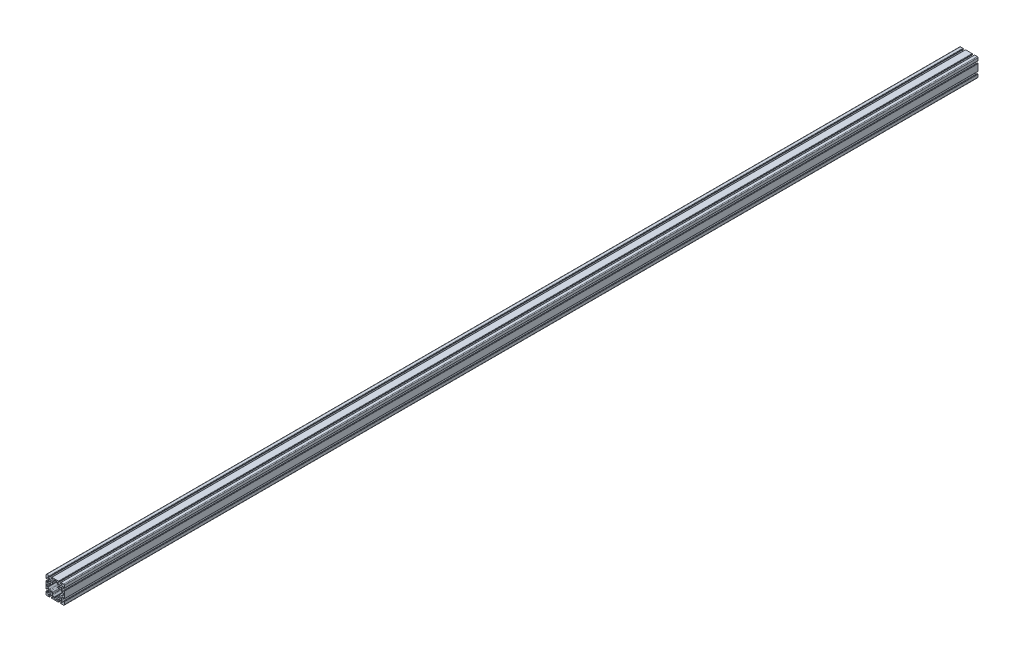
SolidWorks part; units mm, degrees
ref_plane "Front Plane" through (0, 0, 0) normal (0, 0, 1) x (1, 0, 0)
ref_plane "Top Plane" through (0, 0, 0) normal (0, 1, 0) x (1, 0, 0)
ref_plane "Right Plane" through (0, 0, 0) normal (1, 0, 0) x (0, 0, -1)
sketch "Sketch1" plane through (0, 0, 0) normal (0, 0, 1) x (1, 0, 0)
  line L0 (0, -40) -> (0, 40) construction
  line L1 (0, 0) -> (-43.5804, 43.5804) construction
  line L2 (-20, 20) -> (-47.7323, 20) construction
  line L3 (-20, 20) -> (3.796, 43.796) construction
  line L4 (-20, 20) -> (-20, 43.5758) construction
  line L5 (-20, -27.7) -> (-20, -47.5576) construction
  line L131 (29.0912, 26.0365) -> (33.0827, 30.028)
  line L132 (27.7, 17.3222) -> (27.7, 22.6778)
  line L133 (29.0912, 13.9635) -> (33.0827, 9.972)
  line L134 (33.6201, 9.7494) -> (34.11, 9.7494)
  line L135 (35.68, 11.3194) -> (35.68, 14.2221)
  line L136 (37.25, 15.7921) -> (38.43, 15.7921)
  line L137 (40, 14.2221) -> (40, 7.0214)
  line L138 (40, 7.0214) -> (40, -7.0214)
  line L139 (40, -7.0214) -> (40, -14.2221)
  line L140 (38.43, -15.7921) -> (37.25, -15.7921)
  line L141 (35.68, -14.2221) -> (35.68, -11.3194)
  line L142 (33.6201, -9.7494) -> (34.11, -9.7494)
  line L143 (29.0912, -13.9635) -> (33.0827, -9.972)
  line L144 (27.7, -22.6778) -> (27.7, -17.3222)
  line L145 (29.0912, -26.0365) -> (33.0827, -30.028)
  line L146 (33.6201, -30.2506) -> (34.11, -30.2506)
  line L147 (35.68, -28.6806) -> (35.68, -25.7779)
  line L148 (37.25, -24.2079) -> (38.43, -24.2079)
  line L149 (40, -25.7779) -> (40, -33.0259)
  line L150 (40, -33.0259) -> (40, -36.83)
  line L151 (36.83, -40) -> (32.9998, -40)
  line L152 (32.9998, -40) -> (25.5696, -40)
  line L153 (23.9996, -38.43) -> (23.9996, -37.25)
  line L154 (25.5696, -35.68) -> (28.4723, -35.68)
  line L155 (30.0413, -34.0552) -> (30.0171, -33.3605)
  line L156 (29.7949, -32.8496) -> (26.0365, -29.0912)
  line L157 (17.3222, -27.7) -> (22.6778, -27.7)
  line L158 (10.035, -33.0197) -> (13.9635, -29.0912)
  line L159 (9.8124, -33.8926) -> (9.8124, -33.5571)
  line L160 (11.3824, -35.4626) -> (14.4246, -35.4626)
  line L161 (15.9946, -37.0326) -> (15.9946, -38.43)
  line L162 (14.4246, -40) -> (6.9987, -40)
  line L163 (6.9987, -40) -> (-6.9987, -40)
  line L164 (-6.9987, -40) -> (-14.4292, -40)
  line L165 (-15.9992, -38.43) -> (-15.9992, -37.25)
  line L166 (-14.4292, -35.68) -> (-11.5265, -35.68)
  line L167 (-9.9574, -34.0552) -> (-9.9816, -33.3618)
  line L168 (-10.2038, -32.8509) -> (-13.9635, -29.0912)
  line L169 (-22.6778, -27.7) -> (-17.3222, -27.7)
  line L170 (-30.028, -33.0827) -> (-26.0365, -29.0912)
  line L171 (-30.2506, -34.11) -> (-30.2506, -33.6201)
  line L172 (-28.6806, -35.68) -> (-25.7231, -35.68)
  line L173 (-24.1531, -37.25) -> (-24.1531, -38.43)
  line L174 (-25.7231, -40) -> (-33, -40)
  line L175 (-33, -40) -> (-36.83, -40)
  line L176 (-40, -36.83) -> (-40, -33.0191)
  line L177 (-40, -33.0191) -> (-40, -25.591)
  line L178 (-38.43, -24.021) -> (-37.25, -24.021)
  line L179 (-35.68, -28.4937) -> (-35.68, -25.591)
  line L180 (-34.0552, -30.0627) -> (-33.3827, -30.0392)
  line L181 (-32.8718, -29.8171) -> (-29.0912, -26.0365)
  line L182 (-27.7, -22.6778) -> (-27.7, -17.3222)
  line L183 (-29.0912, -13.9635) -> (-33.0827, -9.972)
  line L184 (-34.11, -9.7494) -> (-33.6201, -9.7494)
  line L185 (-35.68, -11.3194) -> (-35.68, -14.4473)
  line L186 (-38.43, -16.0173) -> (-37.25, -16.0173)
  line L187 (-40, -14.4473) -> (-40, -7.0169)
  line L188 (-40, -7.0169) -> (-40, 7.0169)
  line L189 (-40, 7.0169) -> (-40, 14.1348)
  line L190 (-38.1948, 15.94) -> (-36.9772, 15.94)
  line L191 (-35.68, 11.3194) -> (-35.68, 14.6428)
  line L192 (-34.11, 9.7494) -> (-33.6201, 9.7494)
  line L193 (-33.0827, 9.972) -> (-29.0912, 13.9635)
  line L194 (-27.7, 17.3222) -> (-27.7, 22.6778)
  line L195 (-29.0912, 26.0365) -> (-33.0827, 30.028)
  line L196 (-34.11, 30.2506) -> (-33.6201, 30.2506)
  line L197 (-35.68, 28.6806) -> (-35.68, 25.3572)
  line L198 (-38.1948, 24.06) -> (-36.9772, 24.06)
  line L199 (-40, 25.8652) -> (-40, 33.3181)
  line L200 (-40, 33.3181) -> (-40, 36.83)
  line L201 (-36.83, 40) -> (-33.0314, 40)
  line L202 (-33.0314, 40) -> (-25.8652, 40)
  line L203 (-24.06, 36.9772) -> (-24.06, 38.1948)
  line L204 (-25.3572, 35.68) -> (-28.7018, 35.68)
  line L205 (-30.285, 33.6069) -> (-30.285, 34.0968)
  line L206 (-30.0961, 33.1508) -> (-26.0365, 29.0912)
  line L207 (-22.6778, 27.7) -> (-17.3222, 27.7)
  line L208 (-13.9635, 29.0912) -> (-9.9039, 33.1508)
  line L209 (-9.715, 33.6069) -> (-9.715, 34.0968)
  line L210 (-14.6428, 35.68) -> (-11.2982, 35.68)
  line L211 (-15.94, 36.9772) -> (-15.94, 38.1948)
  line L212 (-14.1348, 40) -> (-6.9844, 40)
  line L213 (-6.9844, 40) -> (6.9844, 40)
  line L214 (6.9844, 40) -> (14.1348, 40)
  line L215 (15.94, 36.9772) -> (15.94, 38.1948)
  line L216 (14.6428, 35.68) -> (11.2982, 35.68)
  line L217 (9.715, 33.6069) -> (9.715, 34.0968)
  line L218 (9.9039, 33.1508) -> (13.9635, 29.0912)
  line L219 (17.3222, 27.7) -> (22.6778, 27.7)
  line L220 (26.0365, 29.0912) -> (30.028, 33.0827)
  line L221 (30.2506, 33.6201) -> (30.2506, 34.11)
  line L222 (25.5409, 35.679) -> (28.6258, 35.679)
  line L223 (23.9709, 37.249) -> (23.9709, 38.43)
  line L224 (25.5409, 40) -> (36.83, 40)
  line L226 (40, 36.83) -> (40, 32.9339)
  line L227 (40, 32.9339) -> (40, 25.7779)
  line L228 (38.43, 24.2079) -> (37.0956, 24.2079)
  line L229 (35.5256, 25.7779) -> (35.5256, 28.6806)
  line L230 (33.6201, 30.2506) -> (33.9556, 30.2506)
  line L231 (17.07, 12.32) -> (22.6578, 12.32)
  line L232 (26.0165, 10.9288) -> (31.1439, 5.8014)
  line L233 (32.0419, 5.4294) -> (34.41, 5.4294)
  line L234 (35.68, -4.1594) -> (35.68, 4.1594)
  line L235 (32.0419, -5.4294) -> (34.41, -5.4294)
  line L236 (26.0165, -10.9288) -> (31.1439, -5.8014)
  line L237 (17.07, -12.32) -> (22.6578, -12.32)
  line L238 (12.32, -22.6578) -> (12.32, -17.07)
  line L239 (5.8014, -31.1439) -> (10.9288, -26.0165)
  line L240 (5.4294, -34.41) -> (5.4294, -32.0419)
  line L241 (-4.1594, -35.68) -> (4.1594, -35.68)
  line L242 (-5.4294, -34.41) -> (-5.4294, -32.0419)
  line L243 (-5.8014, -31.1439) -> (-10.9288, -26.0165)
  line L244 (-12.32, -22.6578) -> (-12.32, -17.07)
  line L245 (-22.6578, -12.32) -> (-17.07, -12.32)
  line L246 (-26.0165, -10.9288) -> (-31.1439, -5.8014)
  line L247 (-34.41, -5.4294) -> (-32.0419, -5.4294)
  line L248 (-35.68, -4.1594) -> (-35.68, 4.1594)
  line L249 (-34.41, 5.4294) -> (-32.0419, 5.4294)
  line L250 (-31.1439, 5.8014) -> (-26.0165, 10.9288)
  line L251 (-22.6578, 12.32) -> (-17.07, 12.32)
  line L252 (-12.32, 17.07) -> (-12.32, 22.6578)
  line L253 (-10.9288, 26.0165) -> (-5.8014, 31.1439)
  line L254 (-5.4294, 32.0419) -> (-5.4294, 34.41)
  line L255 (-4.1594, 35.68) -> (4.1594, 35.68)
  line L256 (5.4294, 32.0419) -> (5.4294, 34.41)
  line L257 (5.8014, 31.1439) -> (10.9288, 26.0165)
  line L258 (12.32, 17.07) -> (12.32, 22.6578)
  line L260 (-40, 0) -> (40, 0) construction
  circle A116 centre (-20, 20) radius 3.4
  circle A117 centre (20, 20) radius 3.4
  circle A118 centre (20, -20) radius 3.4
  circle A119 centre (-20, -20) radius 3.4
  arc A120 (29.0912, 26.0365) -> (27.7, 22.6778) centre (32.45, 22.6778) ccw
  arc A121 (27.7, 17.3222) -> (29.0912, 13.9635) centre (32.45, 17.3222) ccw
  arc A122 (33.0827, 9.972) -> (33.6201, 9.7494) centre (33.6201, 10.5094) ccw
  arc A123 (34.11, 9.7494) -> (35.68, 11.3194) centre (34.11, 11.3194) ccw
  arc A124 (37.25, 15.7921) -> (35.68, 14.2221) centre (37.25, 14.2221) ccw
  arc A125 (40, 14.2221) -> (38.43, 15.7921) centre (38.43, 14.2221) ccw
  arc A126 (38.43, -15.7921) -> (40, -14.2221) centre (38.43, -14.2221) ccw
  arc A127 (35.68, -14.2221) -> (37.25, -15.7921) centre (37.25, -14.2221) ccw
  arc A128 (35.68, -11.3194) -> (34.11, -9.7494) centre (34.11, -11.3194) ccw
  arc A129 (33.6201, -9.7494) -> (33.0827, -9.972) centre (33.6201, -10.5094) ccw
  arc A130 (29.0912, -13.9635) -> (27.7, -17.3222) centre (32.45, -17.3222) ccw
  arc A131 (27.7, -22.6778) -> (29.0912, -26.0365) centre (32.45, -22.6778) ccw
  arc A132 (33.0827, -30.028) -> (33.6201, -30.2506) centre (33.6201, -29.4906) ccw
  arc A133 (34.11, -30.2506) -> (35.68, -28.6806) centre (34.11, -28.6806) ccw
  arc A134 (37.25, -24.2079) -> (35.68, -25.7779) centre (37.25, -25.7779) ccw
  arc A135 (40, -25.7779) -> (38.43, -24.2079) centre (38.43, -25.7779) ccw
  arc A136 (36.83, -40) -> (40, -36.83) centre (36.83, -36.83) ccw
  arc A137 (23.9996, -38.43) -> (25.5696, -40) centre (25.5696, -38.43) ccw
  arc A138 (25.5696, -35.68) -> (23.9996, -37.25) centre (25.5696, -37.25) ccw
  arc A139 (28.4723, -35.68) -> (30.0413, -34.0552) centre (28.4723, -34.11) ccw
  arc A140 (30.0171, -33.3605) -> (29.7949, -32.8496) centre (29.2575, -33.387) ccw
  arc A141 (26.0365, -29.0912) -> (22.6778, -27.7) centre (22.6778, -32.45) ccw
  arc A142 (17.3222, -27.7) -> (13.9635, -29.0912) centre (17.3222, -32.45) ccw
  arc A143 (10.035, -33.0197) -> (9.8124, -33.5571) centre (10.5724, -33.5571) ccw
  arc A144 (9.8124, -33.8926) -> (11.3824, -35.4626) centre (11.3824, -33.8926) ccw
  arc A145 (15.9946, -37.0326) -> (14.4246, -35.4626) centre (14.4246, -37.0326) ccw
  arc A146 (14.4246, -40) -> (15.9946, -38.43) centre (14.4246, -38.43) ccw
  arc A147 (-15.9992, -38.43) -> (-14.4292, -40) centre (-14.4292, -38.43) ccw
  arc A148 (-14.4292, -35.68) -> (-15.9992, -37.25) centre (-14.4292, -37.25) ccw
  arc A149 (-11.5265, -35.68) -> (-9.9574, -34.0552) centre (-11.5265, -34.11) ccw
  arc A150 (-9.9816, -33.3618) -> (-10.2038, -32.8509) centre (-10.7412, -33.3883) ccw
  arc A151 (-13.9635, -29.0912) -> (-17.3222, -27.7) centre (-17.3222, -32.45) ccw
  arc A152 (-22.6778, -27.7) -> (-26.0365, -29.0912) centre (-22.6778, -32.45) ccw
  arc A153 (-30.028, -33.0827) -> (-30.2506, -33.6201) centre (-29.4906, -33.6201) ccw
  arc A154 (-30.2506, -34.11) -> (-28.6806, -35.68) centre (-28.6806, -34.11) ccw
  arc A155 (-24.1531, -37.25) -> (-25.7231, -35.68) centre (-25.7231, -37.25) ccw
  arc A156 (-25.7231, -40) -> (-24.1531, -38.43) centre (-25.7231, -38.43) ccw
  arc A157 (-40, -36.83) -> (-36.83, -40) centre (-36.83, -36.83) ccw
  arc A158 (-38.43, -24.021) -> (-40, -25.591) centre (-38.43, -25.591) ccw
  arc A159 (-35.68, -25.591) -> (-37.25, -24.021) centre (-37.25, -25.591) ccw
  arc A160 (-35.68, -28.4937) -> (-34.0552, -30.0627) centre (-34.11, -28.4937) ccw
  arc A161 (-33.3827, -30.0392) -> (-32.8718, -29.8171) centre (-33.4092, -29.2797) ccw
  arc A162 (-29.0912, -26.0365) -> (-27.7, -22.6778) centre (-32.45, -22.6778) ccw
  arc A163 (-27.7, -17.3222) -> (-29.0912, -13.9635) centre (-32.45, -17.3222) ccw
  arc A164 (-33.0827, -9.972) -> (-33.6201, -9.7494) centre (-33.6201, -10.5094) ccw
  arc A165 (-34.11, -9.7494) -> (-35.68, -11.3194) centre (-34.11, -11.3194) ccw
  arc A166 (-37.25, -16.0173) -> (-35.68, -14.4473) centre (-37.25, -14.4473) ccw
  arc A167 (-40, -14.4473) -> (-38.43, -16.0173) centre (-38.43, -14.4473) ccw
  arc A168 (-38.1948, 15.94) -> (-40, 14.1348) centre (-38.1948, 14.1348) ccw
  arc A169 (-35.68, 14.6428) -> (-36.9772, 15.94) centre (-36.9772, 14.6428) ccw
  arc A170 (-35.68, 11.3194) -> (-34.11, 9.7494) centre (-34.11, 11.3194) ccw
  arc A171 (-33.6201, 9.7494) -> (-33.0827, 9.972) centre (-33.6201, 10.5094) ccw
  arc A172 (-29.0912, 13.9635) -> (-27.7, 17.3222) centre (-32.45, 17.3222) ccw
  arc A173 (-27.7, 22.6778) -> (-29.0912, 26.0365) centre (-32.45, 22.6778) ccw
  arc A174 (-33.0827, 30.028) -> (-33.6201, 30.2506) centre (-33.6201, 29.4906) ccw
  arc A175 (-34.11, 30.2506) -> (-35.68, 28.6806) centre (-34.11, 28.6806) ccw
  arc A176 (-36.9772, 24.06) -> (-35.68, 25.3572) centre (-36.9772, 25.3572) ccw
  arc A177 (-40, 25.8652) -> (-38.1948, 24.06) centre (-38.1948, 25.8652) ccw
  arc A178 (-36.83, 40) -> (-40, 36.83) centre (-36.83, 36.83) ccw
  arc A179 (-24.06, 38.1948) -> (-25.8652, 40) centre (-25.8652, 38.1948) ccw
  arc A180 (-25.3572, 35.68) -> (-24.06, 36.9772) centre (-25.3572, 36.9772) ccw
  arc A181 (-28.7018, 35.68) -> (-30.285, 34.0968) centre (-28.7018, 34.0968) ccw
  arc A182 (-30.285, 33.6069) -> (-30.0961, 33.1508) centre (-29.6399, 33.6069) ccw
  arc A183 (-26.0365, 29.0912) -> (-22.6778, 27.7) centre (-22.6778, 32.45) ccw
  arc A184 (-17.3222, 27.7) -> (-13.9635, 29.0912) centre (-17.3222, 32.45) ccw
  arc A185 (-9.9039, 33.1508) -> (-9.715, 33.6069) centre (-10.3601, 33.6069) ccw
  arc A186 (-9.715, 34.0968) -> (-11.2982, 35.68) centre (-11.2982, 34.0968) ccw
  arc A187 (-15.94, 36.9772) -> (-14.6428, 35.68) centre (-14.6428, 36.9772) ccw
  arc A188 (-14.1348, 40) -> (-15.94, 38.1948) centre (-14.1348, 38.1948) ccw
  arc A189 (15.94, 38.1948) -> (14.1348, 40) centre (14.1348, 38.1948) ccw
  arc A190 (14.6428, 35.68) -> (15.94, 36.9772) centre (14.6428, 36.9772) ccw
  arc A191 (11.2982, 35.68) -> (9.715, 34.0968) centre (11.2982, 34.0968) ccw
  arc A192 (9.715, 33.6069) -> (9.9039, 33.1508) centre (10.3601, 33.6069) ccw
  arc A193 (13.9635, 29.0912) -> (17.3222, 27.7) centre (17.3222, 32.45) ccw
  arc A194 (22.6778, 27.7) -> (26.0365, 29.0912) centre (22.6778, 32.45) ccw
  arc A195 (30.028, 33.0827) -> (30.2506, 33.6201) centre (29.4906, 33.6201) ccw
  arc A196 (30.2506, 34.11) -> (28.6258, 35.679) centre (28.6806, 34.11) ccw
  arc A197 (23.9709, 37.249) -> (25.5409, 35.679) centre (25.5409, 37.249) ccw
  arc A198 (25.5409, 40) -> (23.9709, 38.43) centre (25.5409, 38.43) ccw
  arc A199 (40, 36.83) -> (36.83, 40) centre (36.83, 36.83) ccw
  arc A200 (38.43, 24.2079) -> (40, 25.7779) centre (38.43, 25.7779) ccw
  arc A201 (35.5256, 25.7779) -> (37.0956, 24.2079) centre (37.0956, 25.7779) ccw
  arc A202 (35.5256, 28.6806) -> (33.9556, 30.2506) centre (33.9556, 28.6806) ccw
  arc A203 (33.6201, 30.2506) -> (33.0827, 30.028) centre (33.6201, 29.4906) ccw
  arc A204 (26.0165, 10.9288) -> (22.6578, 12.32) centre (22.6578, 7.57) ccw
  arc A205 (31.1439, 5.8014) -> (32.0419, 5.4294) centre (32.0419, 6.6994) ccw
  arc A206 (35.68, 4.1594) -> (34.41, 5.4294) centre (34.41, 4.1594) ccw
  arc A207 (34.41, -5.4294) -> (35.68, -4.1594) centre (34.41, -4.1594) ccw
  arc A208 (32.0419, -5.4294) -> (31.1439, -5.8014) centre (32.0419, -6.6994) ccw
  arc A209 (22.6578, -12.32) -> (26.0165, -10.9288) centre (22.6578, -7.57) ccw
  arc A210 (17.07, -12.32) -> (12.32, -17.07) centre (17.07, -17.07) ccw
  arc A211 (10.9288, -26.0165) -> (12.32, -22.6578) centre (7.57, -22.6578) ccw
  arc A212 (5.8014, -31.1439) -> (5.4294, -32.0419) centre (6.6994, -32.0419) ccw
  arc A213 (4.1594, -35.68) -> (5.4294, -34.41) centre (4.1594, -34.41) ccw
  arc A214 (-5.4294, -34.41) -> (-4.1594, -35.68) centre (-4.1594, -34.41) ccw
  arc A215 (-5.4294, -32.0419) -> (-5.8014, -31.1439) centre (-6.6994, -32.0419) ccw
  arc A216 (-12.32, -22.6578) -> (-10.9288, -26.0165) centre (-7.57, -22.6578) ccw
  arc A217 (-12.32, -17.07) -> (-17.07, -12.32) centre (-17.07, -17.07) ccw
  arc A218 (-26.0165, -10.9288) -> (-22.6578, -12.32) centre (-22.6578, -7.57) ccw
  arc A219 (-31.1439, -5.8014) -> (-32.0419, -5.4294) centre (-32.0419, -6.6994) ccw
  arc A220 (-35.68, -4.1594) -> (-34.41, -5.4294) centre (-34.41, -4.1594) ccw
  arc A221 (-34.41, 5.4294) -> (-35.68, 4.1594) centre (-34.41, 4.1594) ccw
  arc A222 (-32.0419, 5.4294) -> (-31.1439, 5.8014) centre (-32.0419, 6.6994) ccw
  arc A223 (-22.6578, 12.32) -> (-26.0165, 10.9288) centre (-22.6578, 7.57) ccw
  arc A224 (-17.07, 12.32) -> (-12.32, 17.07) centre (-17.07, 17.07) ccw
  arc A225 (-10.9288, 26.0165) -> (-12.32, 22.6578) centre (-7.57, 22.6578) ccw
  arc A226 (-5.8014, 31.1439) -> (-5.4294, 32.0419) centre (-6.6994, 32.0419) ccw
  arc A227 (-4.1594, 35.68) -> (-5.4294, 34.41) centre (-4.1594, 34.41) ccw
  arc A228 (5.4294, 34.41) -> (4.1594, 35.68) centre (4.1594, 34.41) ccw
  arc A229 (5.4294, 32.0419) -> (5.8014, 31.1439) centre (6.6994, 32.0419) ccw
  arc A230 (12.32, 22.6578) -> (10.9288, 26.0165) centre (7.57, 22.6578) ccw
  arc A231 (12.32, 17.07) -> (17.07, 12.32) centre (17.07, 17.07) ccw
  dimension "D8" = 6.8
  dimension "D1" = 80
  dimension "D2" = 40
  dimension "D3" = 20
  dimension "D4" = 20.57
  dimension "D5" = 4.32
  dimension "D6" = 4.32
  dimension "D7" = 8.12
  dimension "D9" = 4.32
  dimension "D10" = 12.3
extrude "Extrude1" add sketch "Sketch1" against normal blind 4000
